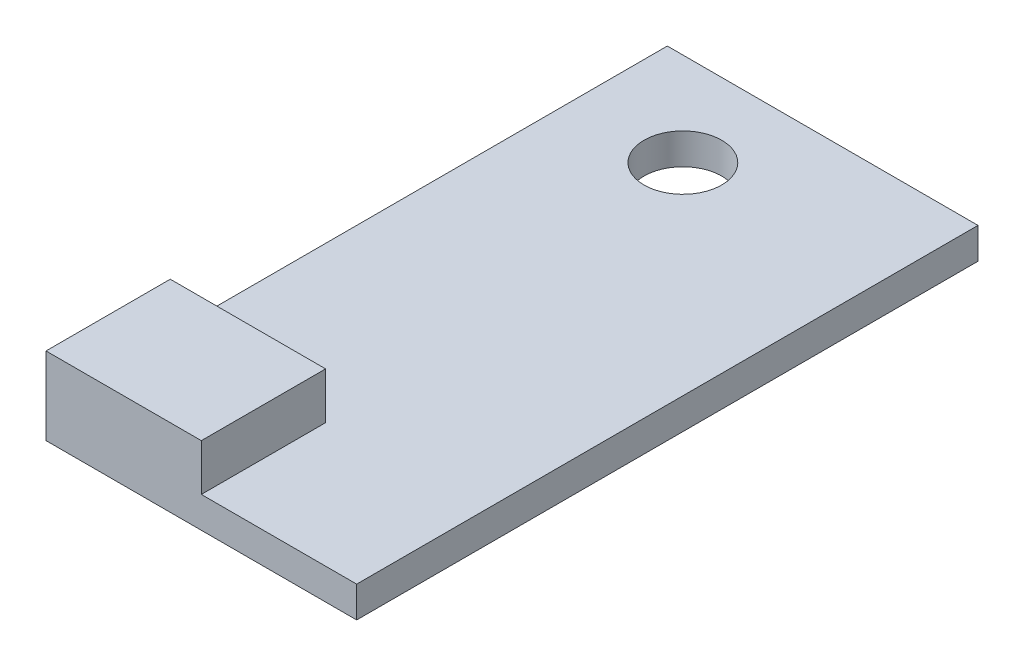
SolidWorks part; units mm, degrees
ref_plane "Front Plane" through (0, 0, 0) normal (0, 0, 1) x (1, 0, 0)
ref_plane "Top Plane" through (0, 0, 0) normal (0, 1, 0) x (1, 0, 0)
ref_plane "Right Plane" through (0, 0, 0) normal (1, 0, 0) x (0, 0, -1)
sketch "Sketch1" plane through (0, 0, 0) normal (0, 1, 0) x (1, 0, 0)
  line L1 (0, 0) -> (100, 0)
  line L2 (0, 0) -> (0, 200)
  line L3 (0, 200) -> (100, 200)
  line L4 (100, 0) -> (100, 200)
  dimension "D1" = 100
  dimension "D2" = 200
extrude "Extrude1" add sketch "Sketch1" along normal blind 10
sketch "Sketch2" plane through (0, 0, 0) normal (0, -1, 0) x (1, 0, 0)
  line L1 (0, 0) -> (50, 0)
  line L2 (0, 0) -> (0, -40)
  line L3 (0, -40) -> (50, -40)
  line L4 (50, 0) -> (50, -40)
  dimension "D1" = 50
  dimension "D2" = 40
extrude "Extrude2" add sketch "Sketch2" against normal blind 25
hole_wizard "M25.0 (25) Diameter Hole1" positions "Sketch4" profile "Sketch3" hole size "M25.0" standard "Ansi Metric"
sketch "Sketch4" plane through (0, 10, 0) normal (0, 1, 0) x (-1, 0, 0)
  line L0 (0, -200) -> (0, -40) construction
  line L1 (-100, -200) -> (0, -200) construction
  point P0 (-35, -170)
  dimension "D1" = 35
  dimension "D2" = 30
sketch "Sketch3" plane through (35, 10, -170) normal (1, 0, 0) x (0, 0, 1)
  line L0 (0, 0) -> (0, 10)
  line L1 (0, 10) -> (12.5, 10)
  line L2 (12.5, 10) -> (12.5, 0)
  line L5 (12.5, 0) -> (0, 0)
  line L11 (0, -6.35) -> (0, 107.95) construction
  dimension "Thru Hole Dia." = 25
  dimension "Thru Hole Depth" = 10
